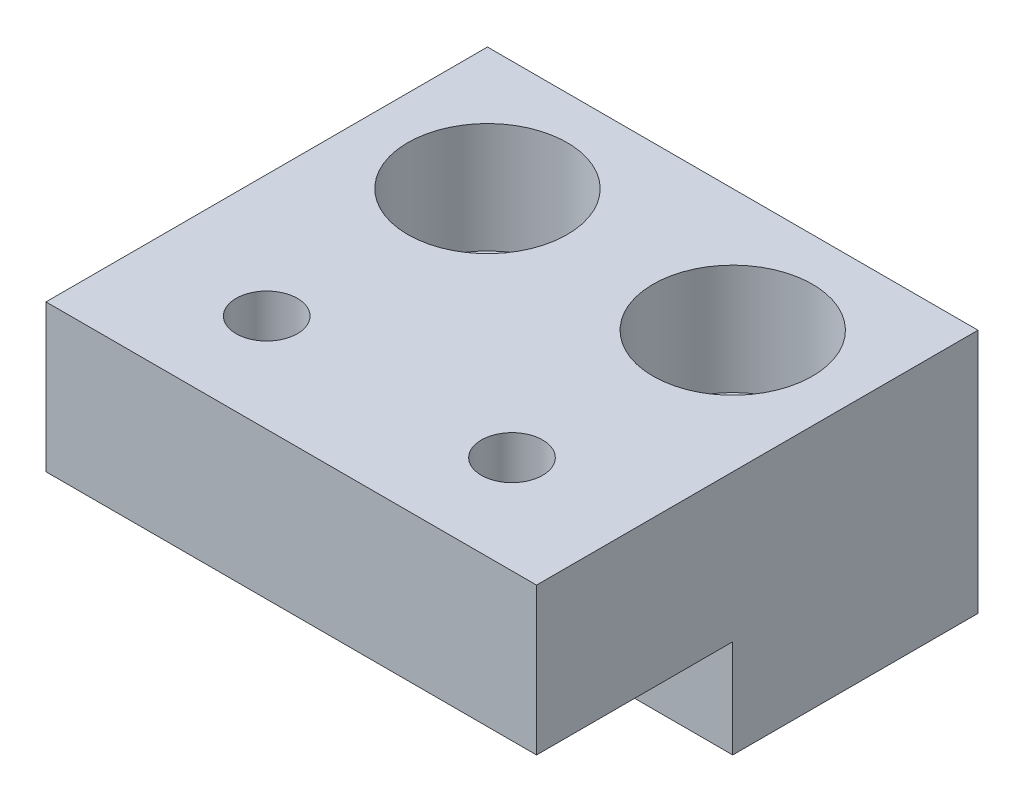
SolidWorks part; units mm, degrees
ref_plane "前视基准面" through (0, 0, 0) normal (0, 0, 1) x (1, 0, 0)
ref_plane "上视基准面" through (0, 0, 0) normal (0, 1, 0) x (1, 0, 0)
ref_plane "右视基准面" through (0, 0, 0) normal (1, 0, 0) x (0, 0, -1)
sketch "草图1" plane through (0, 0, 0) normal (0, 1, 0) x (1, 0, 0)
  line L0 (0, -18) -> (0, 0)
  line L1 (20, -18) -> (20, 0)
  line L2 (0, 0) -> (20, 0)
  line L3 (0, -18) -> (20, -18)
  circle A0 centre (5, -5) radius 1.75
  circle A1 centre (15, -5) radius 1.75
  circle A2 centre (5, -14) radius 1.25
  circle A3 centre (15, -14) radius 1.25
extrude "凸台-拉伸1" add sketch "草图1" along normal blind 10
sketch "草图2" plane through (0, 10, 0) normal (0, 1, 0) x (1, 0, 0)
  circle A0 centre (5, -5) radius 3.25
  circle A1 centre (15, -5) radius 3.25
extrude "切除-拉伸1" cut sketch "草图2" against normal blind 4.5
sketch "草图3" plane through (20, 0, 0) normal (1, 0, 0) x (0, 0, -1)
  line L0 (-10, 0) -> (-10, 4)
  line L1 (-18, 4) -> (-10, 4)
extrude "切除-拉伸2" cut sketch "草图3" against normal through all and the other way through all flip side to cut
